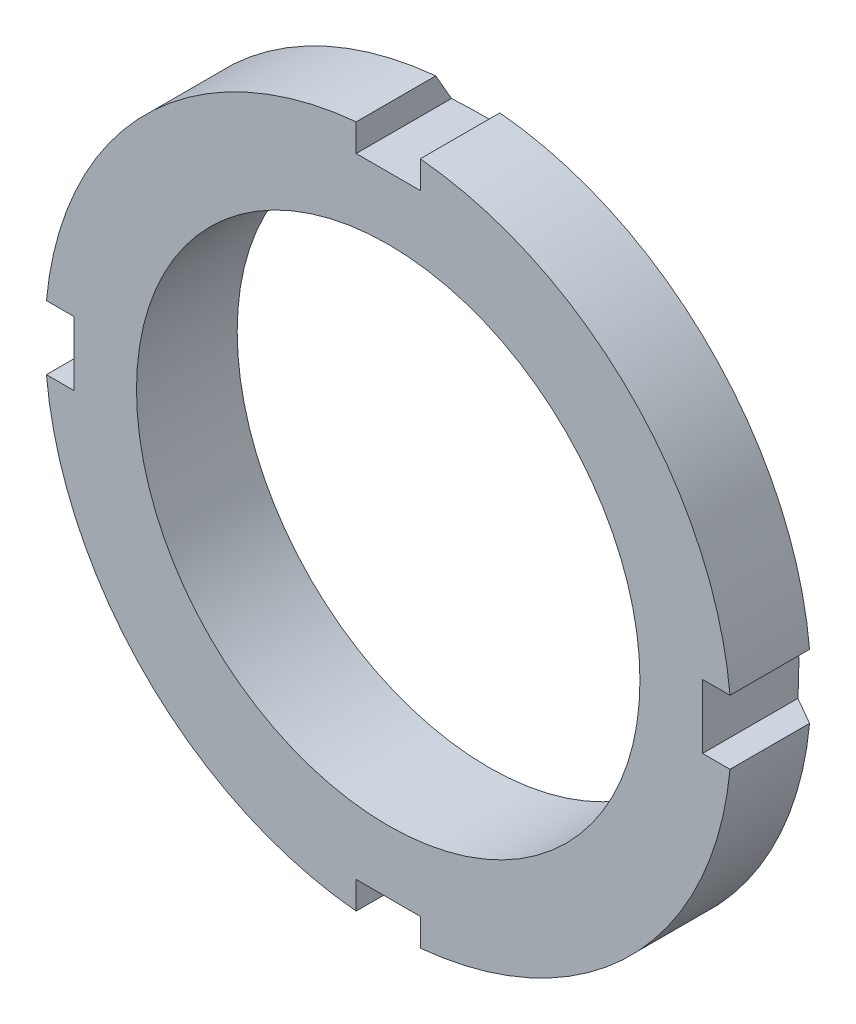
SolidWorks part; units mm, degrees
ref_plane "Face" through (0, 0, 0) normal (0, 0, 1) x (1, 0, 0)
ref_plane "Dessus" through (0, 0, 0) normal (0, 1, 0) x (1, 0, 0)
ref_plane "Droite" through (0, 0, 0) normal (1, 0, 0) x (0, 0, -1)
sketch "Esquisse1" plane through (0, 0, 0) normal (1, 0, 0) x (0, 0, -1)
  line L0 (0, 0) -> (-2, 0) construction
  line L1 (0, 27.5) -> (0, 33.5)
  line L2 (0, 33.5) -> (-2.3094, 37.5)
  line L3 (-2.3094, 37.5) -> (-11, 37.5)
  line L4 (-11, 37.5) -> (-11, 27.5)
  line L5 (-11, 27.5) -> (0, 27.5)
  line L6 (0, 27.5) -> (0, -27.5) construction
  dimension "D2" = 30
  dimension "h" = 11
  dimension "dn" = 55
  dimension "D" = 75
  dimension "d1" = 67
revolve "Base-Révolution" add sketch "Esquisse1" angle 360 about L0
sketch "Esquisse2" plane through (0, 0, 0) normal (0, 0, 1) x (1, 0, 0)
  line L0 (0, 0) -> (0, 34.3363) construction
  line L1 (0, 0) -> (34.3363, 0) construction
  line L2 (-3.5, 34.3363) -> (3.5, 34.3363)
  line L3 (34.3363, 3.5) -> (34.3363, -3.5)
  line L4 (3.5, 34.3363) -> (3.5, 37.3363)
  line L5 (-3.5, 34.3363) -> (-3.5, 37.3363)
  line L6 (34.3363, 3.5) -> (37.3363, 3.5)
  line L7 (34.3363, -3.5) -> (37.3363, -3.5)
  line L8 (-34.3363, -3.5) -> (-37.3363, -3.5)
  line L9 (-34.3363, 3.5) -> (-37.3363, 3.5)
  line L10 (-34.3363, 3.5) -> (-34.3363, -3.5)
  line L11 (-3.5, -34.3363) -> (-3.5, -37.3363)
  line L12 (3.5, -34.3363) -> (3.5, -37.3363)
  line L13 (-3.5, -34.3363) -> (3.5, -34.3363)
  circle A0 centre (0, 0) radius 37.5 construction
  arc A1 (37.3363, 3.5) -> (3.5, 37.3363) centre (0, 0) ccw
  arc A2 (-3.5, 37.3363) -> (-37.3363, 3.5) centre (0, 0) ccw
  arc A3 (-37.3363, -3.5) -> (-3.5, -37.3363) centre (0, 0) ccw
  arc A4 (3.5, -37.3363) -> (37.3363, -3.5) centre (0, 0) ccw
  dimension "g" = 7
  dimension "f" = 3
extrude "Enlèv. mat.-Extru.2" cut sketch "Esquisse2" along normal through all flip side to cut
